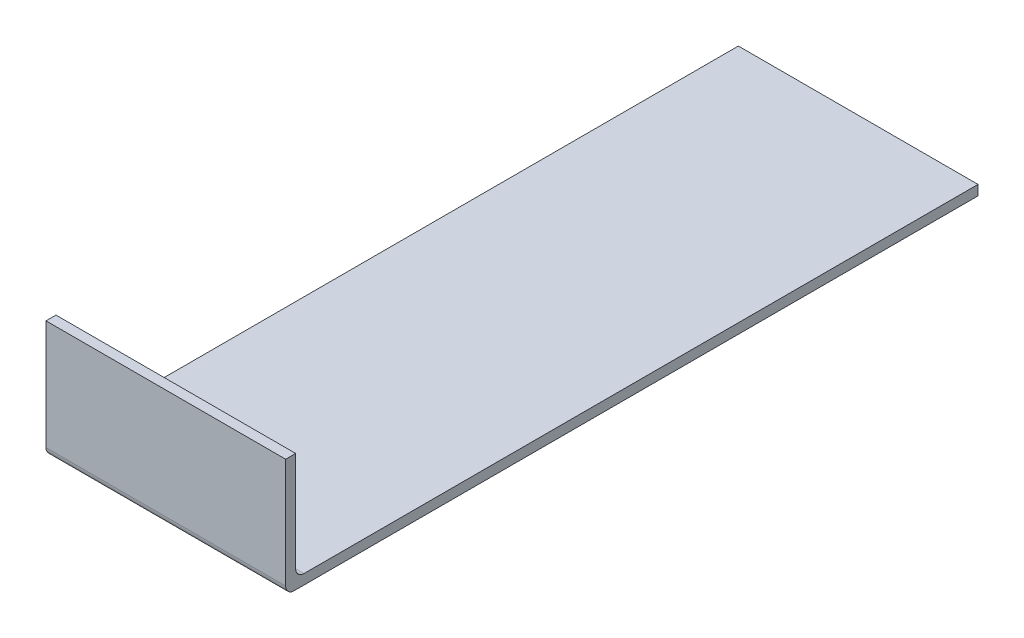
SolidWorks part; units mm, degrees
ref_plane "前视基准面" through (0, 0, 0) normal (0, 0, 1) x (1, 0, 0)
ref_plane "上视基准面" through (0, 0, 0) normal (0, 1, 0) x (1, 0, 0)
ref_plane "右视基准面" through (0, 0, 0) normal (1, 0, 0) x (0, 0, -1)
sketch "草图1" plane through (0, 0, 0) normal (0, 0, 1) x (1, 0, 0)
  line L1 (0, 0) -> (144, 0)
  line L2 (0, 0) -> (0, 6)
  line L3 (0, 6) -> (144, 6)
  line L4 (144, 0) -> (144, 6)
  dimension "D1" = 6
  dimension "D2" = 144
extrude "拉伸1" add sketch "草图1" along normal blind 416
sketch "草图2" plane through (0, 6, 0) normal (0, 1, 0) x (1, 0, 0)
  line L0 (144, -416) -> (144, 0) construction
  line L1 (0, -416) -> (144, -416)
  line L2 (0, -416) -> (0, -410)
  line L3 (0, -410) -> (144, -410)
  line L4 (144, -416) -> (144, -410)
  dimension "D1" = 6
extrude "拉伸2" add sketch "草图2" along normal blind 65
fillet "圆角1" radius 5 2 edges at (72, 0, 416)
